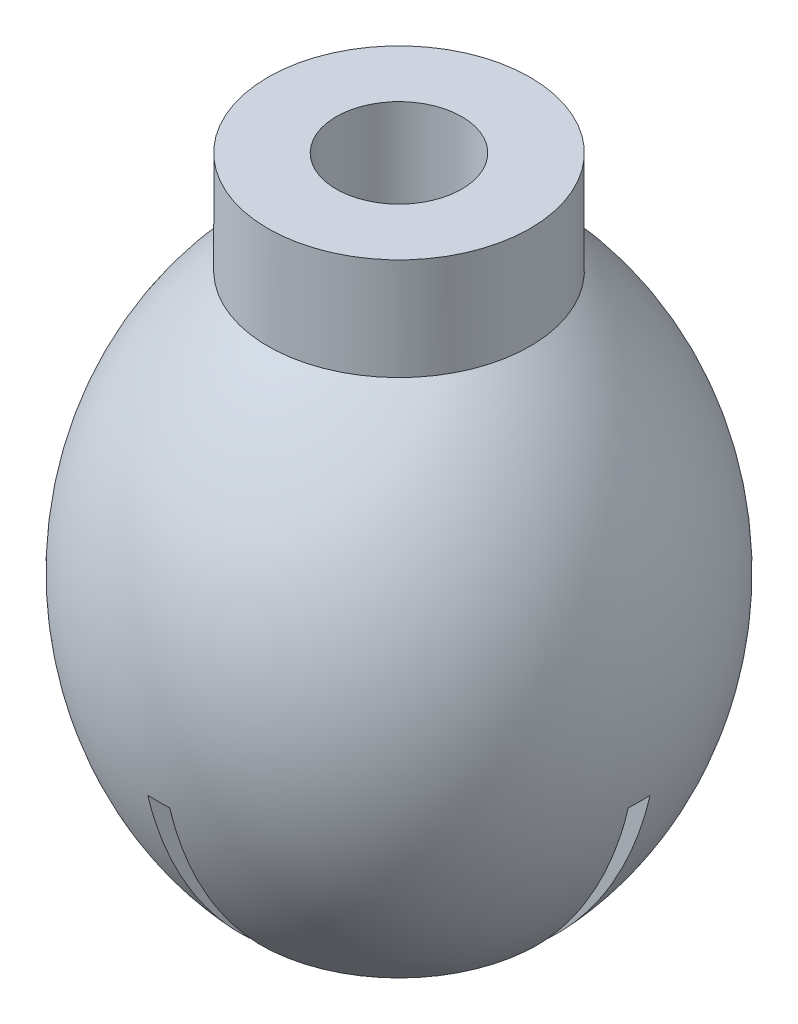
SolidWorks part; units mm, degrees
ref_plane "Front Plane" through (0, 0, 0) normal (0, 0, 1) x (1, 0, 0)
ref_plane "Top Plane" through (0, 0, 0) normal (0, 1, 0) x (1, 0, 0)
ref_plane "Right Plane" through (0, 0, 0) normal (1, 0, 0) x (0, 0, -1)
sketch "Sketch1" plane through (0, 0, 0) normal (0, 0, 1) x (1, 0, 0)
  line L0 (0, 0) -> (0, 30.9966) construction
  line L1 (-6.4587, 3.6356) -> (-5.6596, 3.6356)
  line L2 (-6.096, 32.3011) -> (-6.096, 27.5598)
  line L3 (-6.096, 32.3011) -> (-2.921, 32.3011)
  line L4 (-2.921, 32.3011) -> (-2.921, 21.3791)
  line L5 (-2.921, 21.3791) -> (-1.5768, 21.3791)
  line L6 (-1.5768, 21.3791) -> (-1.5768, 12.2429)
  arc A1 (-6.096, 27.5598) -> (-6.4587, 3.6356) centre (4.4806, 15.4346) ccw
  arc A3 (-1.5768, 12.2429) -> (-5.6596, 3.6356) centre (0, 6.223) ccw
  dimension "D1" = 2.921
  dimension "D3" = 16.0899
  dimension "D4" = 6.223
  dimension "D2" = 3.1536
  dimension "D5" = 3.175
  dimension "D6" = 10.922
revolve "Revolve1" add sketch "Sketch1" angle 360 about L0
sketch "Sketch2" plane through (0, 3.6356, 0) normal (0, -1, 0) x (1, 0, 0)
  line L2 (-0.508, 12.2115) -> (-0.508, 0.508)
  line L3 (-12.2115, -0.508) -> (-0.508, -0.508)
  line L4 (0.508, 12.2115) -> (0.508, 0.508)
  line L5 (-12.2115, 0.508) -> (-0.508, 0.508)
  line L6 (-0.508, -0.508) -> (-0.508, -12.2115)
  line L8 (0.508, 0.508) -> (12.2115, 0.508)
  line L11 (0.508, -0.508) -> (0.508, -12.2115)
  line L14 (0.508, -0.508) -> (12.2115, -0.508)
  arc A0 (-12.2115, 0.508) -> (-12.2115, -0.508) centre (0, 0) ccw
  arc A1 (0.508, 12.2115) -> (-0.508, 12.2115) centre (0, 0) ccw
  arc A2 (12.2115, -0.508) -> (12.2115, 0.508) centre (0, 0) ccw
  arc A3 (-0.508, -12.2115) -> (0.508, -12.2115) centre (0, 0) ccw
extrude "Cut-Extrude1" cut sketch "Sketch2" against normal blind 8.128
fillet "Fillet1" radius 2.54 1 edges at (0, 12.2429, -1.5768)
